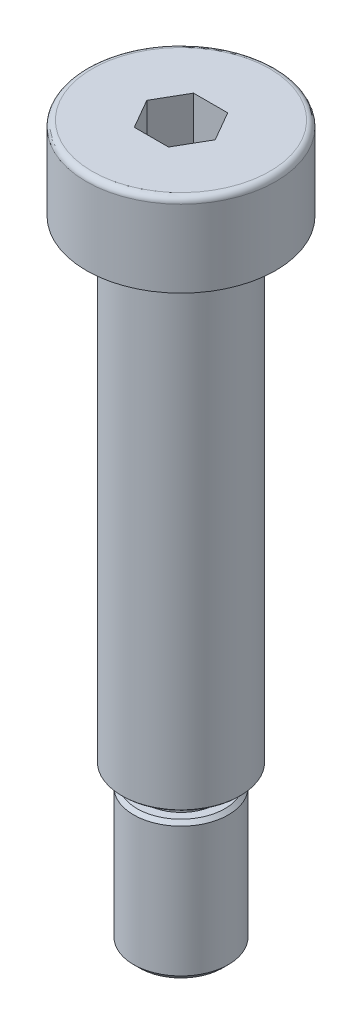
SolidWorks part; units mm, degrees
ref_plane "Plan1" through (0, 0, 0) normal (0, 0, 1) x (1, 0, 0)
ref_plane "Plan2" through (0, 0, 0) normal (0, 1, 0) x (1, 0, 0)
ref_plane "Plan3" through (0, 0, 0) normal (1, 0, 0) x (0, 0, -1)
sketch "Esquisse1" plane through (0, 0, 0) normal (0, 0, 1) x (1, 0, 0)
  line L0 (0, 50) -> (0, -40) construction
  line L1 (0, 60.25) -> (-7.5, 60.25)
  line L3 (-8, 59.75) -> (-8, 53.25)
  line L4 (-8, 53.25) -> (-4, 53.25)
  line L5 (-4, 53.25) -> (-4, 51.75)
  line L6 (-4, 51.75) -> (-5, 51.75)
  line L7 (-5, 51.75) -> (-5, 13.25)
  line L8 (-5, 13.25) -> (-3, 13.25)
  line L9 (-3, 13.25) -> (-3, 11.75)
  line L10 (-3, 11.75) -> (-4, 11.75)
  line L11 (-4, 11.75) -> (-4, 0)
  line L12 (-4, 0) -> (0, 0)
  line L13 (0, 60.25) -> (0, 0)
  arc A0 (-8, 59.75) -> (-7.5, 60.25) centre (-7.5, 59.75) cw
  dimension "D1" = 0.5
  dimension "D2" = 16
  dimension "D3" = 13.25
  dimension "D4" = 7
  dimension "D5" = 1
  dimension "D6" = 1.5
  dimension "D7" = 10
  dimension "D8" = 40
  dimension "D9" = 3
  dimension "D10" = 1.5
  dimension "D11" = 8
revolve "Base-Révolution" add sketch "Esquisse1" angle 360 about L0
sketch "Esquisse2" plane through (0, 60.25, 0) normal (0, 1, 0) x (-1, 0, 0)
  line L1 (2.8868, 0) -> (1.4434, 2.5)
  line L2 (1.4434, 2.5) -> (-1.4434, 2.5)
  line L3 (-1.4434, 2.5) -> (-2.8868, 0)
  line L4 (-2.8868, 0) -> (-1.4434, -2.5)
  line L5 (-1.4434, -2.5) -> (1.4434, -2.5)
  line L6 (1.4434, -2.5) -> (2.8868, 0)
  circle A0 centre (0, 0) radius 2.5 construction
  dimension "D1" = 5
extrude "Enlèv. mat.-Extru.1" cut sketch "Esquisse2" against normal blind 5
chamfer "Chanfrein1" distance 0.2 angle 45
fillet "Congé1" radius 0.1
chamfer "Chanfrein2" distance 0.1 angle 45
fillet "Congé2" radius 0.2
chamfer "Chanfrein3" distance 0.5 angle 45
chamfer "Chanfrein4" distance 0.3 angle 45
